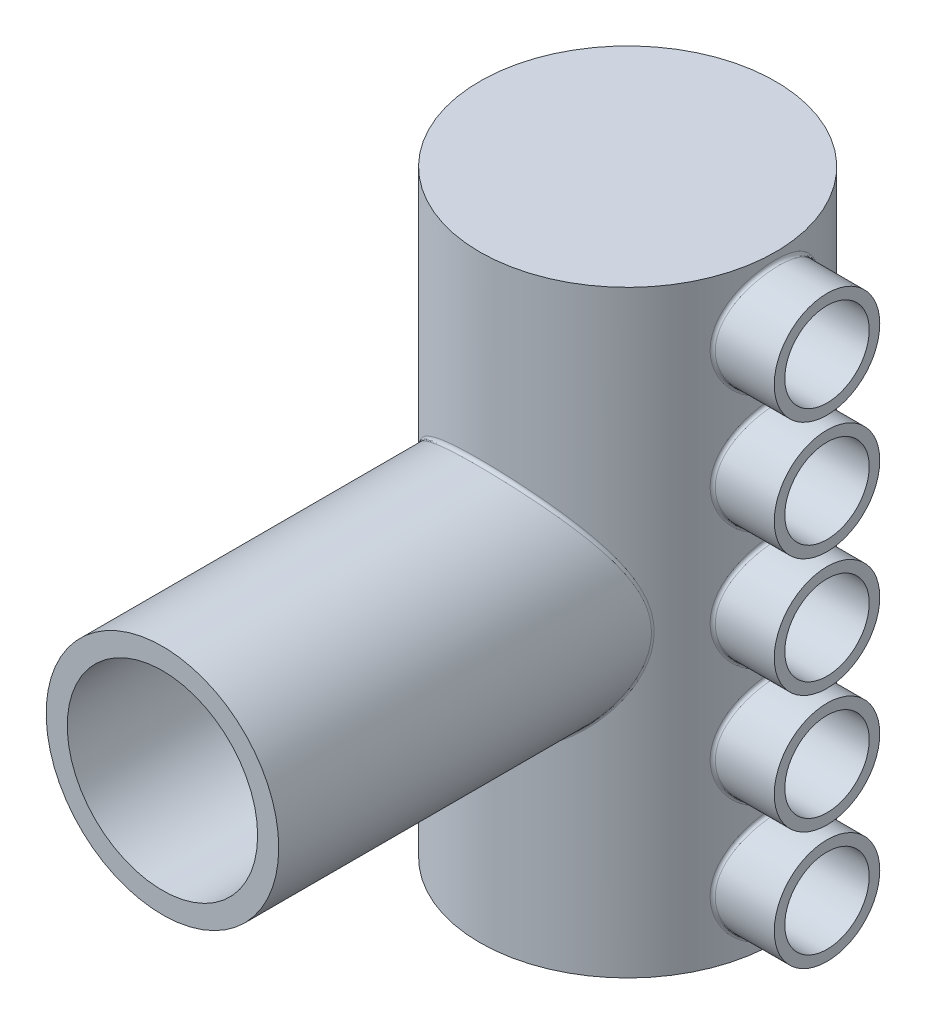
SolidWorks part; units mm, degrees
ref_plane "Alzado" through (0, 0, 0) normal (0, 0, 1) x (1, 0, 0)
ref_plane "Planta" through (0, 0, 0) normal (0, 1, 0) x (1, 0, 0)
ref_plane "Vista lateral" through (0, 0, 0) normal (1, 0, 0) x (0, 0, -1)
sketch "Croquis1" plane through (0, 0, 0) normal (0, 1, 0) x (1, 0, 0)
  circle A0 centre (0, 0) radius 22.25
  dimension "D1" = 44.5
extrude "Saliente-Extruir1" add sketch "Croquis1" along normal blind 90
sketch "Croquis2" plane through (0, 0, 0) normal (0, 0, 1) x (1, 0, 0)
  line L0 (22.25, 90) -> (-22.25, 0) construction
  line L1 (-22.25, 90) -> (22.25, 0) construction
  circle A0 centre (0, 45) radius 17.5
  dimension "D1" = 35
extrude "Saliente-Extruir2" add sketch "Croquis2" along normal blind 70
sketch "Croquis3" plane through (0, 0, 0) normal (1, 0, 0) x (0, 0, -1)
  line L0 (22.25, 90) -> (-22.25, 90) construction
  circle A0 centre (0, 80.55) radius 7.9375
  circle A1 centre (0, 62.75) radius 7.9375
  circle A2 centre (0, 44.95) radius 7.9375
  circle A3 centre (0, 27.15) radius 7.9375
  circle A4 centre (0, 9.35) radius 7.9375
  circle A5 centre (0, 80.55) radius 6.35
  circle A6 centre (0, 62.75) radius 6.35
  circle A7 centre (0, 44.95) radius 6.35
  circle A8 centre (0, 27.15) radius 6.35
  circle A9 centre (0, 9.35) radius 6.35
  dimension "D1" = 15.875
  dimension "D2" = 12.7
  dimension "D3" = 9.45
  dimension "D4" = 17.8
  dimension "D5" = 17.8
  dimension "D6" = 17.8
  dimension "D7" = 17.8
extrude "Saliente-Extruir3" add sketch "Croquis3" along normal blind 30
shell "Vaciado1" thickness 3.175
ref_plane "Plano1" through (0, 2, 0) normal (0, 1, 0) x (-1, 0, 0)
sketch "Croquis6" plane through (0, 2, 0) normal (0, 1, 0) x (-1, 0, 0)
  circle A0 centre (0, 0) radius 20.25
extrude "Cortar-Extruir2" cut sketch "Croquis6" along normal blind 85
sketch "Croquis7" plane through (30, 0, 0) normal (1, 0, 0) x (0, 0, -1)
  circle A0 centre (0, 80.55) radius 6.35
  circle A1 centre (0, 62.75) radius 6.35
  circle A2 centre (0, 44.95) radius 6.35
  circle A3 centre (0, 27.15) radius 6.35
  circle A4 centre (0, 9.35) radius 6.35
extrude "Cortar-Extruir3" cut sketch "Croquis7" against normal blind 20
fillet "Redondeo1" radius 0.5 12 edges at (14.2225, 43.2893, 14.4147) (19.2616, 81.676, 6.2494) (19.2616, 63.876, 6.2494) (19.2616, 46.076, 6.2494) (19.2616, 28.276, 6.2494) (19.2616, 10.476, 6.2494) (20.8262, 81.843, -7.8315) (20.8262, 64.043, -7.8315) (20.8262, 46.243, -7.8315) (20.8262, 28.443, -7.8315) (20.8262, 10.643, -7.8315) (17.1699, 48.3832, 14.1513)
